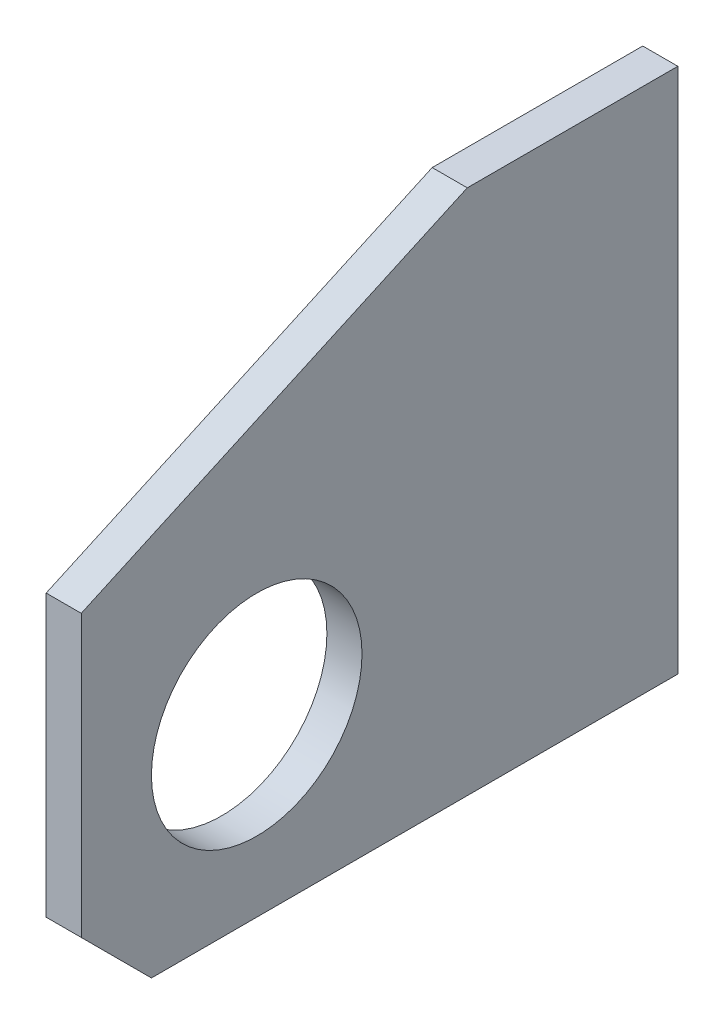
SolidWorks part; units mm, degrees
ref_plane "Front Plane" through (0, 0, 0) normal (0, 0, 1) x (1, 0, 0)
ref_plane "Top Plane" through (0, 0, 0) normal (0, 1, 0) x (1, 0, 0)
ref_plane "Right Plane" through (0, 0, 0) normal (1, 0, 0) x (0, 0, -1)
sketch "Sketch1" plane through (0, 0, 0) normal (1, 0, 0) x (0, 0, -1)
  line L0 (0, 150) -> (0, 0)
  line L3 (0, 0) -> (-170, 0)
  line L4 (-170, 0) -> (-170, 100)
  line L5 (-60, 150) -> (0, 150)
  line L6 (-170, 100) -> (-60, 150)
  dimension "D1" = 150
  dimension "D2" = 170
  dimension "D3" = 60
  dimension "D5" = 100
extrude "Boss-Extrude1" add sketch "Sketch1" along normal blind 10
sketch "Sketch2" plane through (10, 0, 0) normal (1, 0, 0) x (0, 0, -1)
  line L0 (-170, 100) -> (-170, 0) construction
  line L2 (-170, 0) -> (0, 0) construction
  circle A0 centre (-120, 50) radius 30
  dimension "D1" = 60
  dimension "D2" = 50
  dimension "D3" = 50
extrude "Cut-Extrude1" cut sketch "Sketch2" against normal blind 10
chamfer "Chamfer1" distance 20 angle 45 1 edges at (5, 0, 170)
